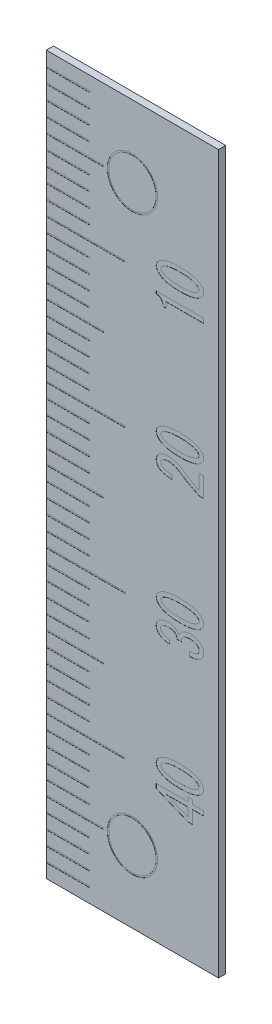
SolidWorks part; units mm, degrees
ref_plane "Front" through (0, 0, 0) normal (0, 0, 1) x (1, 0, 0)
ref_plane "Top" through (0, 0, 0) normal (0, 1, 0) x (1, 0, 0)
ref_plane "Right" through (0, 0, 0) normal (1, 0, 0) x (0, 0, -1)
sketch "Sketch1" plane through (0, 0, 0) normal (0, 0, 1) x (1, 0, 0)
  line L1 (0, 0) -> (0, 50)
  line L2 (0, 0) -> (12, 0)
  line L3 (12, 0) -> (12, 50)
  line L4 (0, 50) -> (12, 50)
  dimension "D1" = 50
  dimension "D2" = 12
extrude "Extrude1" add sketch "Sketch1" along normal blind 0.5
sketch "Sketch2" plane through (0, 0, 0.5) normal (0, 0, 1) x (1, 0, 0)
  line L0 (0, 50) -> (0, 0) construction
  line L1 (0, 0) -> (12, 0) construction
  line L2 (12, 50) -> (0, 50) construction
  circle A0 centre (6, 5) radius 1.75
  circle A1 centre (6, 45) radius 1.75
  circle A2 centre (6, 5) radius 1.65
  circle A3 centre (6, 45) radius 1.65
  dimension "D1" = 6
  dimension "D2" = 6
  dimension "D3" = 5
  dimension "D4" = 5
  dimension "D5" = 3.5
  dimension "D6" = 3.5
  dimension "D7" = 0.1
extrude "Extrude2" cut sketch "Sketch2" against normal blind 0.01
sketch "Sketch3" plane through (0, 0, 0.5) normal (0, 0, 1) x (1, 0, 0)
  line L0 (12, 50) -> (0, 50) construction
  line L1 (7.5, 38.25) -> (11, 38.25) construction
  line L2 (7.5, 38.25) -> (7.5, 41.75) construction
  line L3 (7.5, 41.75) -> (11, 41.75) construction
  line L4 (11, 38.25) -> (11, 41.75) construction
  line L6 (11, 28.25) -> (11, 31.75) construction
  line L7 (11, 18.25) -> (11, 21.75) construction
  line L8 (11, 8.25) -> (11, 11.75) construction
  line L9 (12, 0) -> (12, 50) construction
  text T0 "10" font "ＭＳ ゴシック" height in points 11
  text T1 "20" font "ＭＳ ゴシック" height in points 11
  text T2 "30" font "ＭＳ ゴシック" height in points 11
  text T3 "40" font "ＭＳ ゴシック" height in points 11
  point P4 (11, 40)
  dimension "D1" = 3.5
  dimension "D2" = 10
  dimension "D3" = 1
  dimension "D4" = 3.5
  dimension "D5" = 4
extrude "Extrude3" cut sketch "Sketch3" against normal blind 0.01
sketch "Sketch4" plane through (0, 0, 0.5) normal (0, 0, 1) x (1, 0, 0)
  line L5 (12, 50) -> (0, 50) construction
  line L166 (6, 0) -> (6, 50) construction
  line L167 (0, 0) -> (12, 0) construction
  line L168 (3, 1.05) -> (3, 0.95)
  line L169 (0, 0.95) -> (3, 0.95)
  line L210 (0, 1.05) -> (3, 1.05)
  line L211 (0, 1.05) -> (0, 0.95)
  line L212 (3, 2.05) -> (3, 1.95)
  line L213 (0, 1.95) -> (3, 1.95)
  line L214 (0, 2.05) -> (3, 2.05)
  line L215 (0, 2.05) -> (0, 1.95)
  line L216 (3, 3.05) -> (3, 2.95)
  line L217 (0, 2.95) -> (3, 2.95)
  line L218 (0, 3.05) -> (3, 3.05)
  line L219 (0, 3.05) -> (0, 2.95)
  line L220 (3, 4.05) -> (3, 3.95)
  line L221 (0, 3.95) -> (3, 3.95)
  line L222 (0, 4.05) -> (3, 4.05)
  line L223 (0, 4.05) -> (0, 3.95)
  line L224 (3, 6.05) -> (3, 5.95)
  line L225 (0, 5.95) -> (3, 5.95)
  line L226 (0, 6.05) -> (3, 6.05)
  line L227 (0, 6.05) -> (0, 5.95)
  line L228 (3, 7.05) -> (3, 6.95)
  line L229 (0, 6.95) -> (3, 6.95)
  line L230 (0, 7.05) -> (3, 7.05)
  line L231 (0, 7.05) -> (0, 6.95)
  line L232 (3, 8.05) -> (3, 7.95)
  line L233 (0, 7.95) -> (3, 7.95)
  line L234 (0, 8.05) -> (3, 8.05)
  line L235 (3, 9.05) -> (3, 8.95)
  line L236 (0, 8.95) -> (3, 8.95)
  line L237 (0, 9.05) -> (0, 8.95)
  line L238 (0, 9.05) -> (3, 9.05)
  line L239 (4, 4.95) -> (4, 5.05)
  line L240 (0, 5.05) -> (4, 5.05)
  line L241 (0, 4.95) -> (0, 5.05)
  line L242 (0, 4.95) -> (4, 4.95)
  line L243 (0, 8.05) -> (0, 7.95)
  line L244 (3, 11.05) -> (3, 10.95)
  line L245 (0, 10.95) -> (3, 10.95)
  line L246 (0, 11.05) -> (3, 11.05)
  line L247 (0, 11.05) -> (0, 10.95)
  line L248 (3, 12.05) -> (3, 11.95)
  line L249 (0, 11.95) -> (3, 11.95)
  line L250 (0, 12.05) -> (3, 12.05)
  line L251 (0, 12.05) -> (0, 11.95)
  line L252 (3, 13.05) -> (3, 12.95)
  line L253 (0, 12.95) -> (3, 12.95)
  line L254 (0, 13.05) -> (3, 13.05)
  line L255 (0, 13.05) -> (0, 12.95)
  line L256 (3, 14.05) -> (3, 13.95)
  line L257 (0, 13.95) -> (3, 13.95)
  line L258 (0, 14.05) -> (3, 14.05)
  line L259 (0, 14.05) -> (0, 13.95)
  line L260 (3, 16.05) -> (3, 15.95)
  line L261 (0, 15.95) -> (3, 15.95)
  line L262 (0, 16.05) -> (3, 16.05)
  line L263 (0, 16.05) -> (0, 15.95)
  line L264 (3, 17.05) -> (3, 16.95)
  line L265 (0, 16.95) -> (3, 16.95)
  line L266 (0, 17.05) -> (3, 17.05)
  line L267 (0, 17.05) -> (0, 16.95)
  line L268 (3, 18.05) -> (3, 17.95)
  line L269 (0, 17.95) -> (3, 17.95)
  line L270 (0, 18.05) -> (3, 18.05)
  line L271 (3, 19.05) -> (3, 18.95)
  line L272 (0, 18.95) -> (3, 18.95)
  line L273 (0, 19.05) -> (0, 18.95)
  line L274 (0, 19.05) -> (3, 19.05)
  line L275 (4, 14.95) -> (4, 15.05)
  line L276 (0, 15.05) -> (4, 15.05)
  line L277 (0, 14.95) -> (0, 15.05)
  line L278 (0, 14.95) -> (4, 14.95)
  line L279 (0, 18.05) -> (0, 17.95)
  line L280 (0, 9.95) -> (0, 10.05)
  line L281 (5.5, 9.95) -> (0, 9.95)
  line L282 (5.5, 10.05) -> (5.5, 9.95)
  line L283 (0, 10.05) -> (5.5, 10.05)
  line L284 (3, 21.05) -> (3, 20.95)
  line L285 (0, 20.95) -> (3, 20.95)
  line L286 (0, 21.05) -> (3, 21.05)
  line L287 (0, 21.05) -> (0, 20.95)
  line L288 (3, 22.05) -> (3, 21.95)
  line L289 (0, 21.95) -> (3, 21.95)
  line L290 (0, 22.05) -> (3, 22.05)
  line L291 (0, 22.05) -> (0, 21.95)
  line L292 (3, 23.05) -> (3, 22.95)
  line L293 (0, 22.95) -> (3, 22.95)
  line L294 (0, 23.05) -> (3, 23.05)
  line L295 (0, 23.05) -> (0, 22.95)
  line L296 (3, 24.05) -> (3, 23.95)
  line L297 (0, 23.95) -> (3, 23.95)
  line L298 (0, 24.05) -> (3, 24.05)
  line L299 (0, 24.05) -> (0, 23.95)
  line L300 (3, 26.05) -> (3, 25.95)
  line L301 (0, 25.95) -> (3, 25.95)
  line L302 (0, 26.05) -> (3, 26.05)
  line L303 (0, 26.05) -> (0, 25.95)
  line L304 (3, 27.05) -> (3, 26.95)
  line L305 (0, 26.95) -> (3, 26.95)
  line L306 (0, 27.05) -> (3, 27.05)
  line L307 (0, 27.05) -> (0, 26.95)
  line L308 (3, 28.05) -> (3, 27.95)
  line L309 (0, 27.95) -> (3, 27.95)
  line L310 (0, 28.05) -> (3, 28.05)
  line L311 (3, 29.05) -> (3, 28.95)
  line L312 (0, 28.95) -> (3, 28.95)
  line L313 (0, 29.05) -> (0, 28.95)
  line L314 (0, 29.05) -> (3, 29.05)
  line L315 (4, 24.95) -> (4, 25.05)
  line L316 (0, 25.05) -> (4, 25.05)
  line L317 (0, 24.95) -> (0, 25.05)
  line L318 (0, 24.95) -> (4, 24.95)
  line L319 (0, 28.05) -> (0, 27.95)
  line L320 (0, 19.95) -> (0, 20.05)
  line L321 (5.5, 19.95) -> (0, 19.95)
  line L322 (5.5, 20.05) -> (5.5, 19.95)
  line L323 (0, 20.05) -> (5.5, 20.05)
  line L324 (3, 31.05) -> (3, 30.95)
  line L325 (0, 30.95) -> (3, 30.95)
  line L326 (0, 31.05) -> (3, 31.05)
  line L327 (0, 31.05) -> (0, 30.95)
  line L328 (3, 32.05) -> (3, 31.95)
  line L329 (0, 31.95) -> (3, 31.95)
  line L330 (0, 32.05) -> (3, 32.05)
  line L331 (0, 32.05) -> (0, 31.95)
  line L332 (3, 33.05) -> (3, 32.95)
  line L333 (0, 32.95) -> (3, 32.95)
  line L334 (0, 33.05) -> (3, 33.05)
  line L335 (0, 33.05) -> (0, 32.95)
  line L336 (3, 34.05) -> (3, 33.95)
  line L337 (0, 33.95) -> (3, 33.95)
  line L338 (0, 34.05) -> (3, 34.05)
  line L339 (0, 34.05) -> (0, 33.95)
  line L340 (3, 36.05) -> (3, 35.95)
  line L341 (0, 35.95) -> (3, 35.95)
  line L342 (0, 36.05) -> (3, 36.05)
  line L343 (0, 36.05) -> (0, 35.95)
  line L344 (3, 37.05) -> (3, 36.95)
  line L345 (0, 36.95) -> (3, 36.95)
  line L346 (0, 37.05) -> (3, 37.05)
  line L347 (0, 37.05) -> (0, 36.95)
  line L348 (3, 38.05) -> (3, 37.95)
  line L349 (0, 37.95) -> (3, 37.95)
  line L350 (0, 38.05) -> (3, 38.05)
  line L351 (3, 39.05) -> (3, 38.95)
  line L352 (0, 38.95) -> (3, 38.95)
  line L353 (0, 39.05) -> (0, 38.95)
  line L354 (0, 39.05) -> (3, 39.05)
  line L355 (4, 34.95) -> (4, 35.05)
  line L356 (0, 35.05) -> (4, 35.05)
  line L357 (0, 34.95) -> (0, 35.05)
  line L358 (0, 34.95) -> (4, 34.95)
  line L359 (0, 38.05) -> (0, 37.95)
  line L360 (3, 41.05) -> (3, 40.95)
  line L361 (0, 40.95) -> (3, 40.95)
  line L362 (0, 41.05) -> (3, 41.05)
  line L363 (0, 41.05) -> (0, 40.95)
  line L364 (3, 42.05) -> (3, 41.95)
  line L365 (0, 41.95) -> (3, 41.95)
  line L366 (0, 42.05) -> (3, 42.05)
  line L367 (0, 42.05) -> (0, 41.95)
  line L368 (3, 43.05) -> (3, 42.95)
  line L369 (0, 42.95) -> (3, 42.95)
  line L370 (0, 43.05) -> (3, 43.05)
  line L371 (0, 43.05) -> (0, 42.95)
  line L372 (3, 44.05) -> (3, 43.95)
  line L373 (0, 43.95) -> (3, 43.95)
  line L374 (0, 44.05) -> (3, 44.05)
  line L375 (0, 44.05) -> (0, 43.95)
  line L376 (0, 29.95) -> (0, 30.05)
  line L377 (5.5, 29.95) -> (0, 29.95)
  line L378 (5.5, 30.05) -> (5.5, 29.95)
  line L379 (0, 30.05) -> (5.5, 30.05)
  line L380 (3, 46.05) -> (3, 45.95)
  line L381 (0, 45.95) -> (3, 45.95)
  line L382 (0, 46.05) -> (3, 46.05)
  line L383 (0, 46.05) -> (0, 45.95)
  line L384 (3, 47.05) -> (3, 46.95)
  line L385 (0, 46.95) -> (3, 46.95)
  line L386 (0, 47.05) -> (3, 47.05)
  line L387 (0, 47.05) -> (0, 46.95)
  line L388 (3, 48.05) -> (3, 47.95)
  line L389 (0, 47.95) -> (3, 47.95)
  line L390 (0, 48.05) -> (3, 48.05)
  line L391 (3, 49.05) -> (3, 48.95)
  line L392 (0, 48.95) -> (3, 48.95)
  line L393 (0, 49.05) -> (0, 48.95)
  line L394 (0, 49.05) -> (3, 49.05)
  line L395 (4, 44.95) -> (4, 45.05)
  line L396 (0, 45.05) -> (4, 45.05)
  line L397 (0, 44.95) -> (0, 45.05)
  line L398 (0, 44.95) -> (4, 44.95)
  line L399 (0, 48.05) -> (0, 47.95)
  line L400 (0, 39.95) -> (0, 40.05)
  line L401 (5.5, 39.95) -> (0, 39.95)
  line L402 (5.5, 40.05) -> (5.5, 39.95)
  line L403 (0, 40.05) -> (5.5, 40.05)
extrude "Extrude4" cut sketch "Sketch4" against normal blind 0.01
move or copy body "Body-Move/Copy2" bodies to move or copy 105 copy no translate (0, -50, 0)
